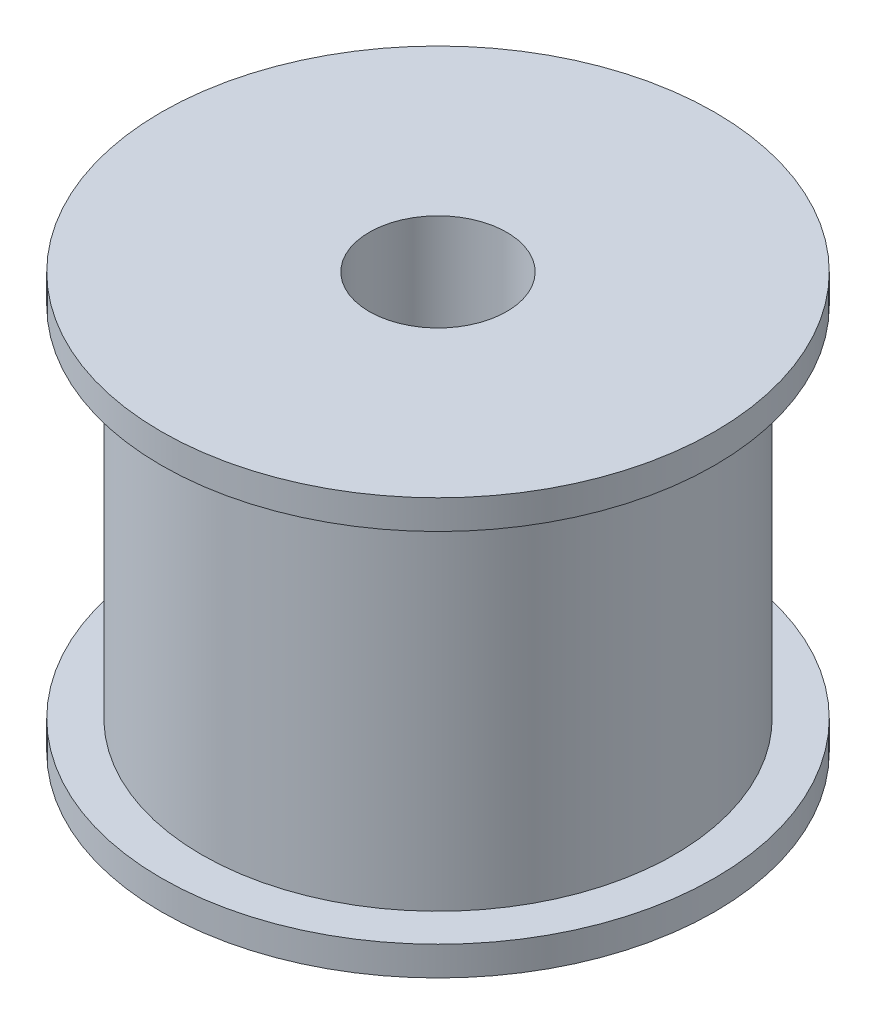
SolidWorks part; units mm, degrees
ref_plane "Front Plane" through (0, 0, 0) normal (0, 0, 1) x (1, 0, 0)
ref_plane "Top Plane" through (0, 0, 0) normal (0, 1, 0) x (1, 0, 0)
ref_plane "Right Plane" through (0, 0, 0) normal (1, 0, 0) x (0, 0, -1)
sketch "Croquis1" plane through (0, 0, 0) normal (0, 0, 1) x (1, 0, 0)
  line L0 (0, -21.0409) -> (0, 21.0409) construction
  line L1 (13.75, 10.4) -> (16.1, 10.4)
  line L2 (0, 10.4) -> (13.75, 10.4) construction
  line L3 (0, 10.4) -> (0, -10.4)
  line L4 (0, -10.4) -> (13.75, -10.4) construction
  line L5 (13.75, 10.4) -> (13.75, -10.4)
  line L6 (16.1, 10.4) -> (16.1, 12.1)
  line L7 (16.1, 12.1) -> (0, 12.1)
  line L8 (0, 12.1) -> (0, 10.4)
  line L9 (0, 0) -> (13.75, 0) construction
  line L10 (0, -10.4) -> (13.75, -10.4) construction
  line L11 (16.1, -12.1) -> (0, -12.1)
  line L12 (16.1, -10.4) -> (16.1, -12.1)
  line L13 (13.75, -10.4) -> (16.1, -10.4)
  line L14 (0, -12.1) -> (0, -10.4)
  point P4 (0, 0)
  point P9 (13.75, 0)
  point P18 (14.925, 10.4)
  dimension "D1" = 27.5
  dimension "D2" = 20.8
  dimension "D3" = 1.7
  dimension "D4" = 32.2
revolve "Revolución1" add sketch "Croquis1" angle 360 about L0
sketch "Croquis2" plane through (0, 12.1, 0) normal (0, 1, 0) x (1, 0, 0)
  circle A0 centre (0, 0) radius 4
  dimension "D1" = 8
extrude "Cortar-Extruir1" cut sketch "Croquis2" against normal through all
